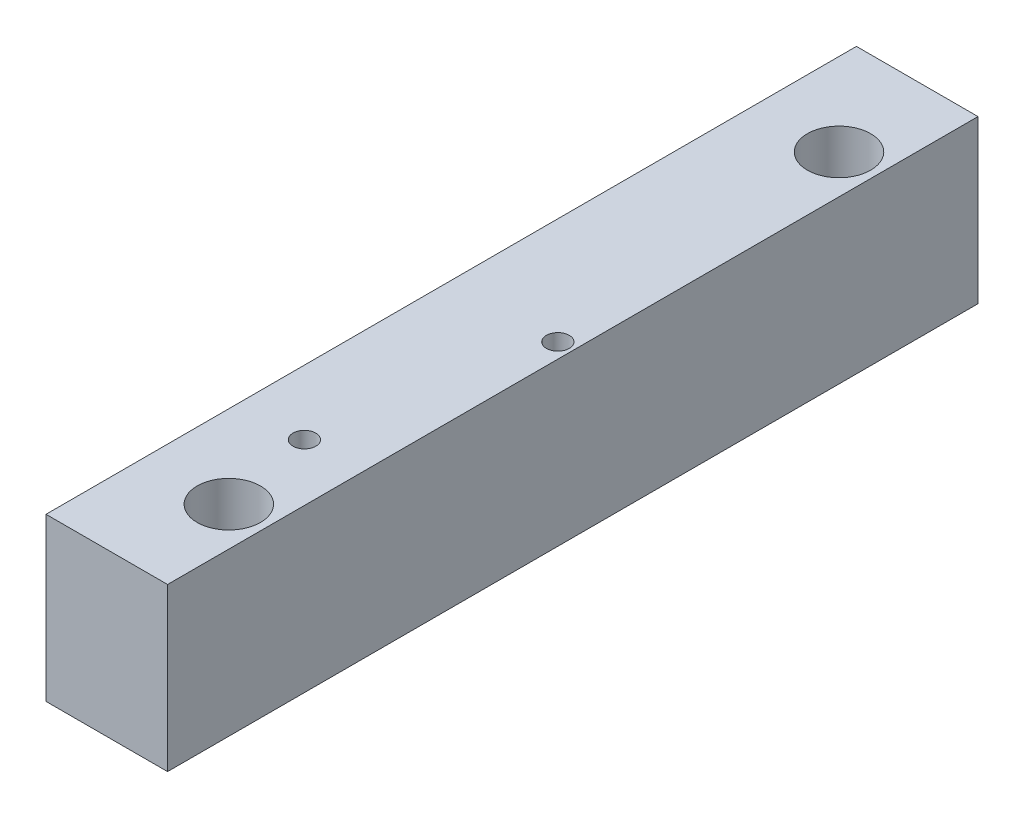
SolidWorks part; units mm, degrees
ref_plane "Front Plane" through (0, 0, 0) normal (0, 0, 1) x (1, 0, 0)
ref_plane "Top Plane" through (0, 0, 0) normal (0, 1, 0) x (1, 0, 0)
ref_plane "Right Plane" through (0, 0, 0) normal (1, 0, 0) x (0, 0, -1)
sketch "Sketch1" plane through (0, 0, 0) normal (0, 0, 1) x (1, 0, 0)
  line L1 (-19.05, -25.4) -> (19.05, -25.4)
  line L2 (-19.05, -25.4) -> (-19.05, 25.4)
  line L3 (-19.05, 25.4) -> (19.05, 25.4)
  line L4 (19.05, -25.4) -> (19.05, 25.4)
  line L5 (-19.05, -25.4) -> (19.05, 25.4) construction
  line L6 (-19.05, 25.4) -> (19.05, -25.4) construction
  point P0 (0, 0)
  dimension "D1" = 38.1
  dimension "D2" = 50.8
extrude "Boss-Extrude1" add sketch "Sketch1" along normal mid plane 254
hole_wizard "25/32 (0.78125) Diameter Hole1" positions "Sketch3" profile "Sketch4" hole size "25/32" standard "ANSI Inch"
sketch "Sketch3" plane through (0, 25.4, 0) normal (0, 1, 0) x (1, 0, 0)
  circle A0 centre (6.8686, -95.6199) radius 9.9219 construction
  circle A1 centre (6.8686, 95.6199) radius 9.9219 construction
  point P0 (6.8686, 95.6199)
  point P2 (6.8686, -95.6199)
sketch "Sketch4" plane through (6.8686, 25.4, -95.6199) normal (1, 0, 0) x (0, 0, 1)
  line L0 (0, 0) -> (0, 50.8)
  line L1 (0, 50.8) -> (9.9219, 50.8)
  line L2 (9.9219, 50.8) -> (9.9219, 0)
  line L5 (9.9219, 0) -> (0, 0)
  line L11 (0, -6.35) -> (0, 107.95) construction
  dimension "Thru Hole Dia." = 19.8438
  dimension "Thru Hole Depth" = 50.8
hole_wizard "9/32 (0.28125) Diameter Hole1" positions "Sketch6" profile "Sketch5" hole size "9/32" standard "ANSI Inch"
sketch "Sketch6" plane through (0, 25.4, 0) normal (0, 1, 0) x (1, 0, 0)
  circle A0 centre (1.1862, -66.2477) radius 3.5719 construction
  circle A1 centre (14.3637, 0) radius 3.5719 construction
  circle A3 centre (-65.7727, 146.026) radius 2.5527 construction
  point P0 (1.1862, -66.2477)
  point P2 (14.3637, 0)
  point P4 (-65.7727, 146.026)
sketch "Sketch5" plane through (1.1862, 25.4, 66.2477) normal (1, 0, 0) x (0, 0, 1)
  line L0 (0, 0) -> (0, 50.8)
  line L1 (0, 50.8) -> (3.5719, 50.8)
  line L2 (3.5719, 50.8) -> (3.5719, 0)
  line L5 (3.5719, 0) -> (0, 0)
  line L11 (0, -6.35) -> (0, 107.95) construction
  dimension "Thru Hole Dia." = 7.1437
  dimension "Thru Hole Depth" = 50.8
